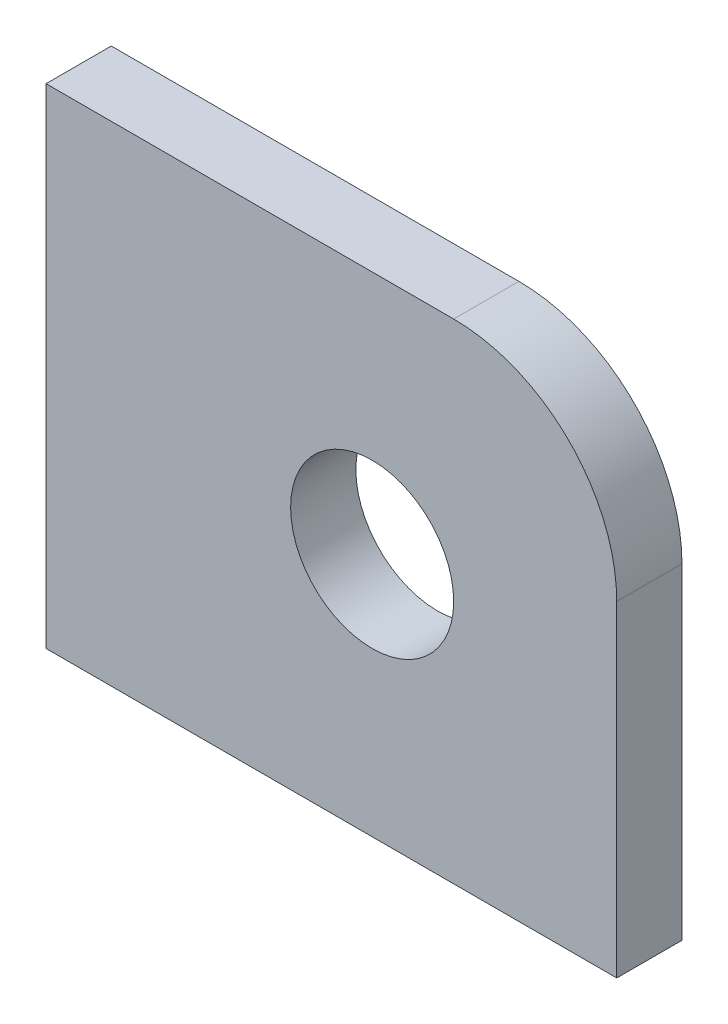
SolidWorks part; units mm, degrees
ref_plane "Face" through (0, 0, 0) normal (0, 0, 1) x (1, 0, 0)
ref_plane "Dessus" through (0, 0, 0) normal (0, 1, 0) x (1, 0, 0)
ref_plane "Droite" through (0, 0, 0) normal (1, 0, 0) x (0, 0, -1)
sketch "Esquisse1" plane through (0, 0, 0) normal (0, 0, 1) x (1, 0, 0)
  line L1 (0, 0) -> (70, 0)
  line L2 (0, 0) -> (0, 60)
  line L3 (0, 60) -> (50, 60)
  line L4 (70, 0) -> (70, 40)
  arc A0 (70, 40) -> (50, 60) centre (50, 40) ccw
  circle A1 centre (40, 30) radius 10
  dimension "D3" = 20
  dimension "D6" = 20
  dimension "D1" = 70
  dimension "D2" = 60
  dimension "D4" = 40
  dimension "D5" = 30
extrude "Base-Extrusion" add sketch "Esquisse1" along normal blind 8
